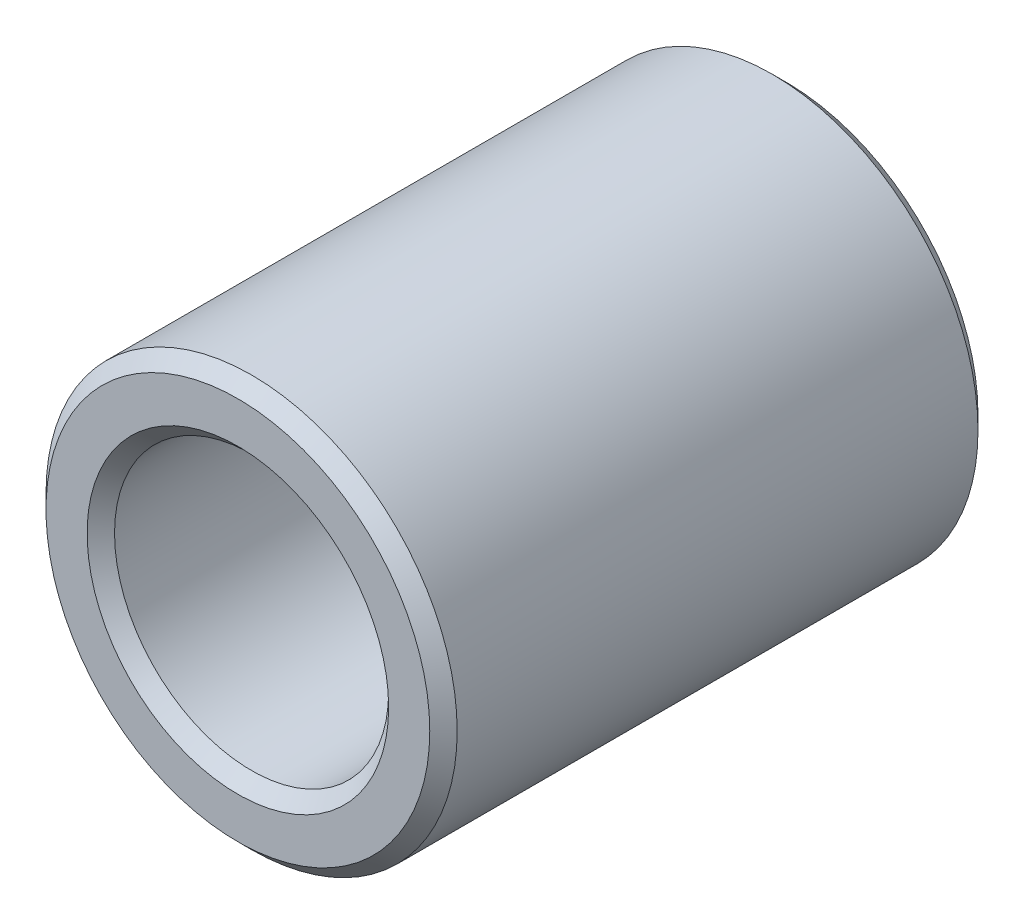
SolidWorks part; units mm, degrees
ref_plane "Front Plane" through (0, 0, 0) normal (0, 0, 1) x (1, 0, 0)
ref_plane "Top Plane" through (0, 0, 0) normal (0, 1, 0) x (1, 0, 0)
ref_plane "Right Plane" through (0, 0, 0) normal (1, 0, 0) x (0, 0, -1)
sketch "Sketch1" plane through (0, 0, 0) normal (0, 0, 1) x (1, 0, 0)
  circle A0 centre (0, 0) radius 40
  circle A1 centre (0, 0) radius 60
  dimension "D1" = 80
  dimension "D2" = 120
extrude "Boss-Extrude1" add sketch "Sketch1" along normal mid plane 160
chamfer "Chamfer1" distance 4 angle 45 4 edges at (40, 0, -80) (60, 0, -80) (40, 0, 80) (60, 0, 80)
